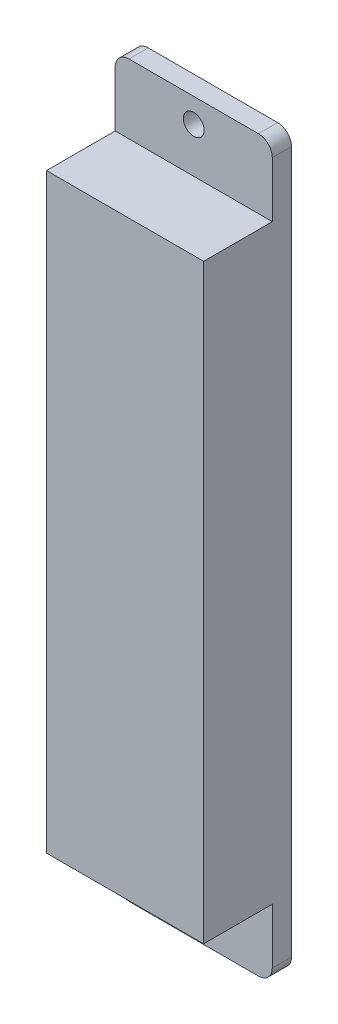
SolidWorks part; units mm, degrees
ref_plane "Front Plane" through (0, 0, 0) normal (0, 0, 1) x (1, 0, 0)
ref_plane "Top Plane" through (0, 0, 0) normal (0, 1, 0) x (1, 0, 0)
ref_plane "Right Plane" through (0, 0, 0) normal (1, 0, 0) x (0, 0, -1)
sketch "Sketch1" plane through (0, 0, 0) normal (0, 0, 1) x (1, 0, 0)
  line L0 (115.8, -40.2) -> (115.8, 40.2)
  line L2 (100.6, 40.2) -> (120.8, 40.2) construction
  line L7 (100.6, 40) -> (120.6, -40) construction
  line L8 (100.6, -40) -> (120.6, 40) construction
  line L9 (100.6, 40.2) -> (115.8, 40.2)
  line L11 (100.6, -40.2) -> (115.8, -40.2)
  line L12 (100.6, 42.7) -> (123.3, 42.7)
  line L13 (123.3, 42.7) -> (123.3, -42.7)
  line L14 (100.6, -42.7) -> (123.3, -42.7)
  line L15 (100.6, 42.7) -> (100.6, 40.2)
  line L16 (100.6, -40.2) -> (100.6, -42.7)
  line L18 (120.8, 40.2) -> (120.8, -40.2) construction
  line L21 (100.6, -40.2) -> (120.8, -40.2) construction
  point P4 (110.6, 0)
  dimension "D1" = 20
  dimension "D4" = 7.5
  dimension "D3" = 2.5
extrude "Boss-Extrude1" add sketch "Sketch1" along normal blind 10.2
sketch "Sketch2" plane through (0, 0, 10.2) normal (0, 0, 1) x (1, 0, 0)
  line L0 (69.4319, 40) -> (109.4319, 40) construction
  line L1 (115.8, -40.2) -> (100.6, -40.2)
  line L2 (115.8, -40.2) -> (115.8, 40)
  line L3 (115.8, 40) -> (100.6, 40)
  line L4 (100.6, -40.2) -> (100.6, 40)
  line L5 (115.8, -40.2) -> (100.6, 40) construction
  line L6 (115.8, 40) -> (100.6, -40.2) construction
  line L7 (100.6, 40) -> (100.6, 40.2)
  line L8 (115.8, -40.2) -> (100.6, -40.2)
  line L9 (115.8, 40.2) -> (115.8, -40.2)
  line L10 (100.6, -42.7) -> (123.3, -42.7)
  line L11 (123.3, -42.7) -> (123.3, 42.7)
  line L12 (123.3, 42.7) -> (100.6, 42.7)
  line L13 (115.8, 40.2) -> (115.8, -40.2)
  line L14 (100.6, 40.2) -> (115.8, 40.2)
  line L15 (100.6, -40.2) -> (100.6, -42.7)
  line L16 (115.8, -40.2) -> (100.6, -40.2)
  line L17 (100.6, -40.2) -> (100.6, -42.7)
  line L18 (100.6, -42.7) -> (123.3, -42.7)
  line L19 (123.3, -42.7) -> (123.3, 42.7)
  line L20 (123.3, 42.7) -> (100.6, 42.7)
  line L21 (100.6, 42.7) -> (100.6, 40.2)
  line L22 (100.6, 40.2) -> (115.8, 40.2)
  line L24 (123.3, 42.7) -> (123.3, -42.7) construction
  line L25 (100.6, -42.7) -> (123.3, -42.7) construction
  line L34 (100.6, 42.7) -> (100.6, 40.2)
  point P8 (108.2, -0.1)
  dimension "D1" = 0
extrude "Boss-Extrude2" add sketch "Sketch2" along normal blind 2.5
sketch "Sketch3" plane through (0, -42.7, 0) normal (0, -1, 0) x (1, 0, 0)
  line L1 (123.3, 0) -> (100.6, 0)
  line L2 (123.3, 0) -> (123.3, 2.7786)
  line L3 (123.3, 2.7786) -> (100.6, 2.7786)
  line L4 (100.6, 0) -> (123.3, 0)
  line L5 (123.3, 0) -> (123.3, 12.7)
  line L6 (123.3, 12.7) -> (100.6, 12.7)
  line L7 (100.6, 12.7) -> (100.6, 0)
  line L8 (100.6, 0) -> (123.3, 0)
  line L9 (123.3, 0) -> (123.3, 12.7)
  line L12 (100.6, 0) -> (100.6, 2.7786)
  line L13 (123.3, 0) -> (100.6, 2.7786) construction
  line L14 (123.3, 2.7786) -> (100.6, 0) construction
  line L18 (123.3, 12.7) -> (100.6, 12.7)
  line L19 (100.6, 12.7) -> (100.6, 0)
  point P6 (111.95, 1.3893)
  dimension "D2" = 2.7786
  dimension "D1" = 0
extrude "Boss-Extrude3" add sketch "Sketch3" along normal blind 10 contours L3 M8 M10 M7
ref_plane "Plane1" through (0, 0, 0) normal (0, -1, 0) x (-1, 0, 0)
mirror "Mirror1" about plane through (0, 0, 0) normal (0, -1, 0) of "Boss-Extrude3"
sketch "Sketch4" plane through (0, 0, 2.7786) normal (0, 0, 1) x (1, 0, 0)
  line L0 (40, 49.2) -> (183.9, 49.2) construction
  line L3 (123.3, 42.7) -> (100.6, 42.7) construction
  line L5 (100.6, 52.7) -> (100.6, 42.7) construction
  circle A0 centre (111.95, 49.2) radius 1.5
  point P9 (111.95, 49.2)
  dimension "D1" = 3
  dimension "D3" = 11.35
  dimension "D2" = 6.5
extrude "Cut-Extrude1" cut sketch "Sketch4" against normal through all
fillet "Fillet1" radius 2 4 edges at (123.3, -52.7, 1.3893) (100.6, -52.7, 1.3893) (123.3, 52.7, 1.3893) (100.6, 52.7, 1.3893)
mirror "Mirror2" about plane through (0, 0, 0) normal (0, -1, 0) of "Cut-Extrude1"
